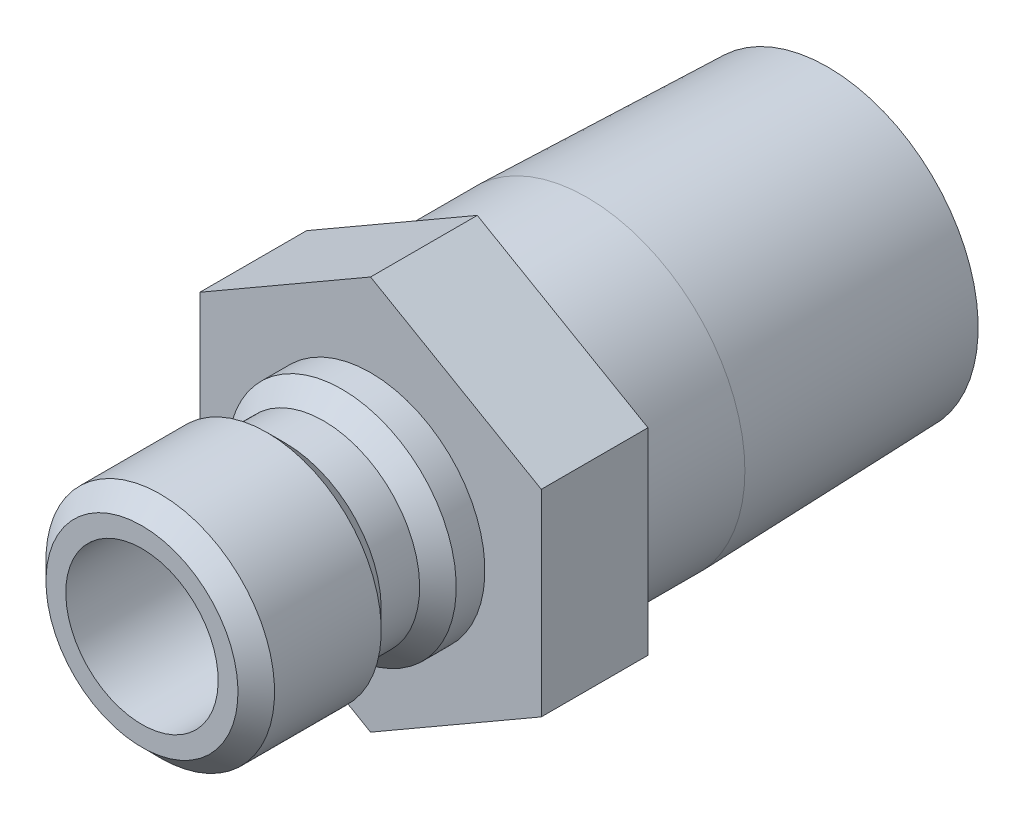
SolidWorks part; units mm, degrees
ref_plane "Front Plane" through (0, 0, 0) normal (0, 0, 1) x (1, 0, 0)
ref_plane "Top Plane" through (0, 0, 0) normal (0, 1, 0) x (1, 0, 0)
ref_plane "Right Plane" through (0, 0, 0) normal (1, 0, 0) x (0, 0, -1)
sketch "Sketch1" plane through (0, 0, 0) normal (1, 0, 0) x (0, 0, -1)
  line L0 (0, 0) -> (-12.7, 0) construction
  line L1 (-9.525, 3.175) -> (-9.525, 4.0005)
  line L2 (-3.556, 4.0005) -> (-3.556, 0) construction
  line L3 (-8.763, 4.7625) -> (-4.318, 4.7625)
  line L4 (0, 6.5786) -> (0, 0) construction
  line L5 (-3.556, 4.0005) -> (-1.9558, 4.0005)
  line L6 (-1.1938, 4.7625) -> (0, 4.7625)
  line L7 (0, 4.7625) -> (0, 6.5786)
  line L8 (-3.556, 4.0005) -> (-4.318, 4.7625)
  line L9 (-1.9558, 4.0005) -> (-1.1938, 4.7625)
  line L10 (-9.525, 4.0005) -> (-8.763, 4.7625)
  line L11 (-9.525, 3.175) -> (0.127, 3.175)
  line L12 (0, 6.5786) -> (9.017, 6.5786)
  line L13 (9.017, 6.5786) -> (19.05, 6.2651)
  line L14 (19.05, 6.2651) -> (19.05, 4.6228)
  line L15 (0, 0) -> (4.445, 0) construction
  line L16 (0.127, 3.175) -> (0.127, 4.6228)
  line L17 (0.127, 4.6228) -> (19.05, 4.6228)
  dimension "D1" = 9.525
  dimension "D2" = 1.6002
  dimension "D3" = 0.762
  dimension "D4" = 45
  dimension "D5" = 5.969
  dimension "D6" = 45
  dimension "D7" = 1.79
  dimension "D8" = 10.033
  dimension "D9" = 28.575
  dimension "D10" = 3.175
  dimension "D11" = 4.445
  dimension "D12" = 6.35
  dimension "D13" = 9.652
  dimension "D14" = 9.525
  dimension "D15" = 13.1572
  dimension "D16" = 9.2456
revolve "Revolve1" add sketch "Sketch1" angle 360 about L0
sketch "Sketch2" plane through (0, 0, 0) normal (0, 0, 1) x (1, 0, 0)
  line L1 (-7.112, 4.1061) -> (-7.112, -4.1061)
  line L2 (-7.112, -4.1061) -> (0, -8.2122)
  line L3 (0, -8.2122) -> (7.112, -4.1061)
  line L4 (7.112, -4.1061) -> (7.112, 4.1061)
  line L5 (7.112, 4.1061) -> (0, 8.2122)
  line L6 (0, 8.2122) -> (-7.112, 4.1061)
  circle A0 centre (0, 0) radius 7.112 construction
  circle A1 centre (0, 0) radius 3.175 construction
  circle A2 centre (0, 0) radius 3.175
  dimension "D1" = 14.224
extrude "Boss-Extrude1" add sketch "Sketch2" against normal up to vertex (4.445 mm away)
